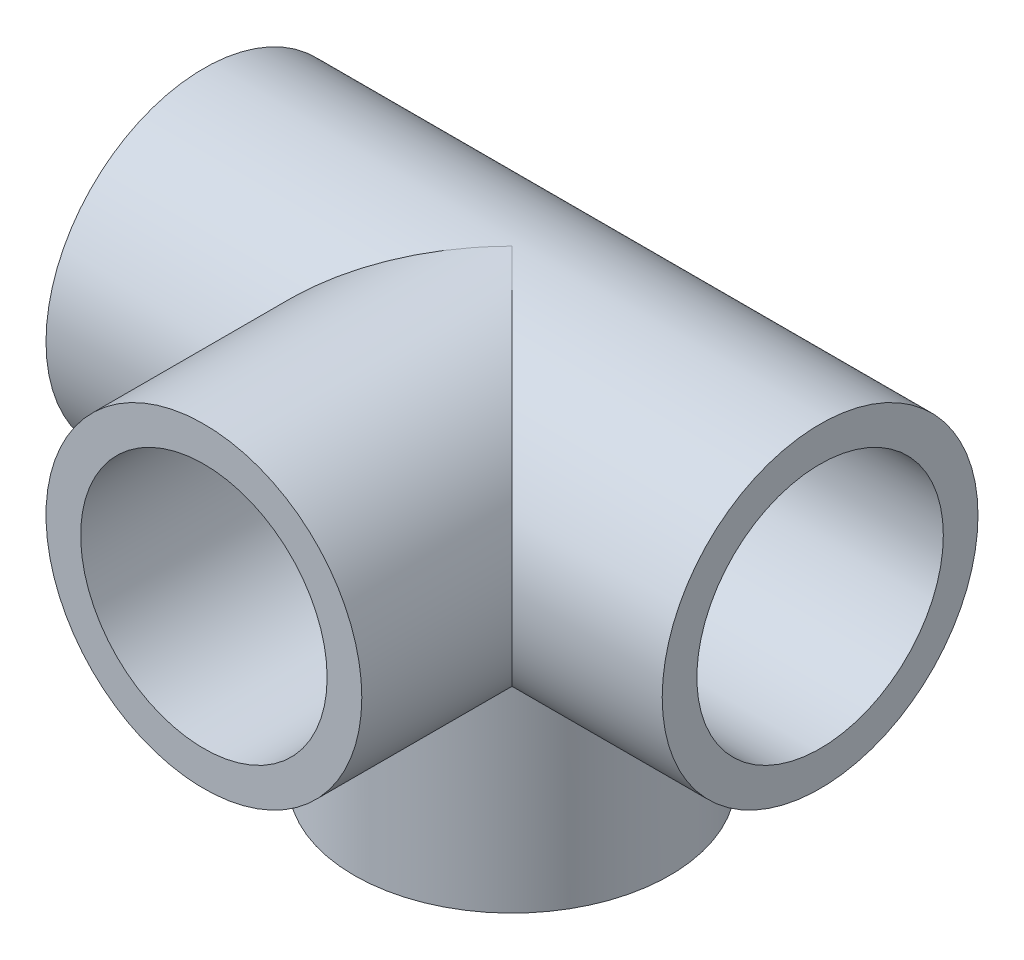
SolidWorks part; units mm, degrees
ref_plane "Front Plane" through (0, 0, 0) normal (0, 0, 1) x (1, 0, 0)
ref_plane "Top Plane" through (0, 0, 0) normal (0, 1, 0) x (1, 0, 0)
ref_plane "Right Plane" through (0, 0, 0) normal (1, 0, 0) x (0, 0, -1)
sketch "Sketch1" plane through (0, 0, 0) normal (1, 0, 0) x (0, 0, -1)
  circle A0 centre (0, 0) radius 16
  dimension "D1" = 32
extrude "Boss-Extrude1" add sketch "Sketch1" along normal mid plane 80
sketch "Sketch2" plane through (0, 0, 0) normal (0, 1, 0) x (1, 0, 0)
  circle A0 centre (0, 0) radius 16
  dimension "D1" = 32
extrude "Boss-Extrude2" add sketch "Sketch2" against normal blind 40
sketch "Sketch3" plane through (0, 0, 0) normal (0, 0, 1) x (1, 0, 0)
  circle A0 centre (0, 0) radius 16
  dimension "D1" = 32
extrude "Boss-Extrude3" add sketch "Sketch3" along normal blind 40
shell "Shell1" thickness 4.5
ref_plane "Plane1" through (-20, 0, 0) normal (-1, 0, 0) x (0, 0, 1)
ref_plane "Plane2" through (20, 0, 0) normal (1, 0, 0) x (0, 0, -1)
ref_plane "Plane3" through (0, -20, 0) normal (0, -1, 0) x (-1, 0, 0)
ref_plane "Plane4" through (0, 0, 20) normal (0, 0, 1) x (1, 0, 0)
